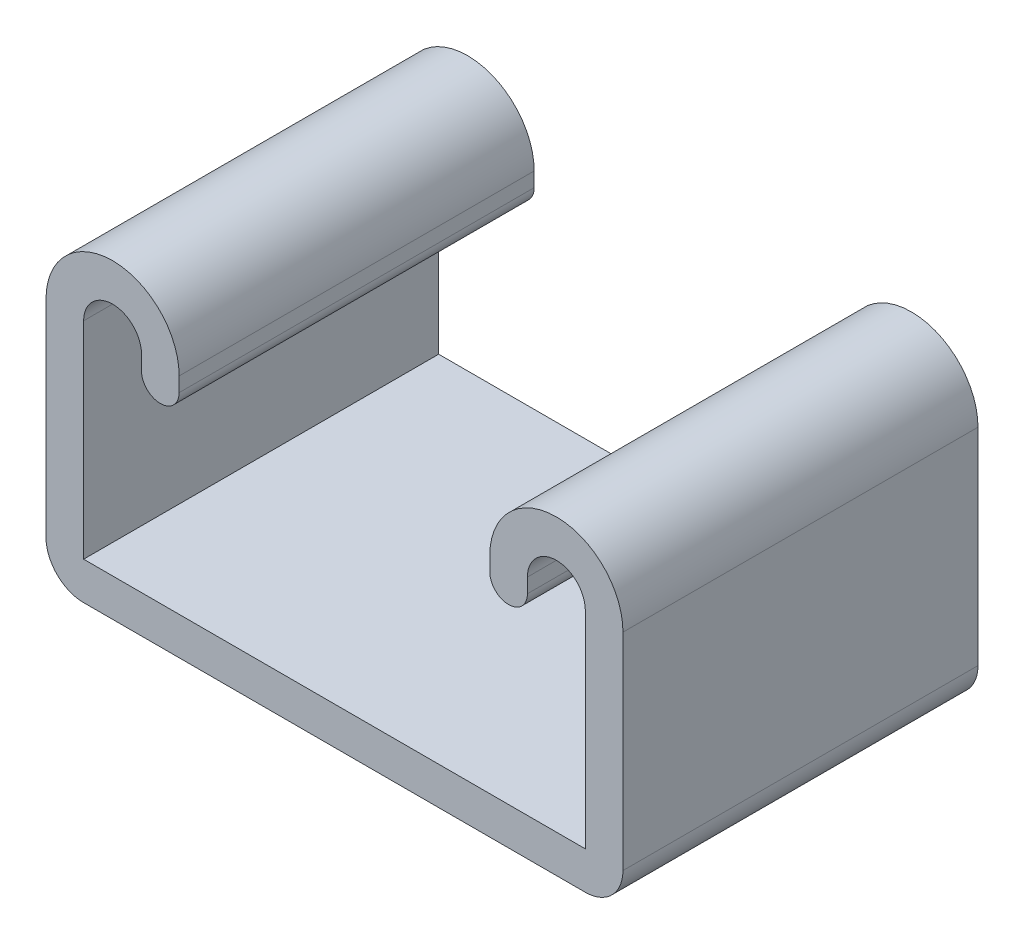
SolidWorks part; units mm, degrees
ref_plane "Plane1" through (0, 0, 0) normal (0, 0, 1) x (1, 0, 0)
ref_plane "Plane2" through (0, 0, 0) normal (0, 1, 0) x (1, 0, 0)
ref_plane "Plane3" through (0, 0, 0) normal (1, 0, 0) x (0, 0, -1)
sketch "Sketch1" plane through (0, 0, 0) normal (0, 0, 1) x (1, 0, 0)
  line L0 (-20.6375, 8.3693) -> (-20.6375, -6.4008)
  line L1 (-17.9451, -9.0932) -> (17.9451, -9.0932)
  line L2 (20.6375, -6.4008) -> (20.6375, 8.3693)
  line L3 (11.1125, 8.3693) -> (11.1125, 7.3343)
  line L4 (-11.1125, 8.3693) -> (-11.1125, 7.3343)
  line L5 (-13.8049, 8.3693) -> (-13.8049, 7.3343)
  line L6 (-17.9451, 8.3693) -> (-17.9451, -6.4008)
  line L7 (-17.9451, -6.4008) -> (17.9451, -6.4008)
  line L8 (17.9451, -6.4008) -> (17.9451, 8.3693)
  line L9 (13.8049, 8.3693) -> (13.8049, 7.3343)
  line L10 (-25.4, 13.1318) -> (25.4, 13.1318) construction
  line L11 (-12.8524, 5.9881) -> (12.8524, 5.9881) construction
  arc A0 (20.6375, 8.3693) -> (11.1125, 8.3693) centre (15.875, 8.3693) ccw
  arc A1 (-20.6375, 8.3693) -> (-11.1125, 8.3693) centre (-15.875, 8.3693) cw
  arc A2 (-17.9451, -9.0932) -> (-20.6375, -6.4008) centre (-17.9451, -6.4008) cw
  arc A3 (17.9451, -9.0932) -> (20.6375, -6.4008) centre (17.9451, -6.4008) ccw
  arc A4 (-17.9451, 8.3693) -> (-13.8049, 8.3693) centre (-15.875, 8.3693) cw
  arc A5 (17.9451, 8.3693) -> (13.8049, 8.3693) centre (15.875, 8.3693) ccw
  arc A6 (11.1125, 7.3343) -> (13.8049, 7.3343) centre (12.4587, 7.3343) ccw
  arc A7 (-11.1125, 7.3343) -> (-13.8049, 7.3343) centre (-12.4587, 7.3343) cw
  dimension "D1" = 2.6924
  dimension "D3" = 20.6375
  dimension "Width" = 41.275
  dimension "D5" = 9.0932
  dimension "D6" = 9.525
  dimension "D7" = 22.225
  dimension "D8" = 13.1318
  dimension "D9" = 7.1437
  dimension "gauge" = 2.6924
extrude "Base-Extrude" add sketch "Sketch1" along normal mid plane 25.4
equation "\"D3@Sketch1\" = \"Width@Sketch1\" / 2"
equation "\"D7@Sketch1\" = \"Width@Sketch1\" - 2 * \"D6@Sketch1\""
equation "\"D1@Sketch1\" = \"gauge@Sketch1\""
